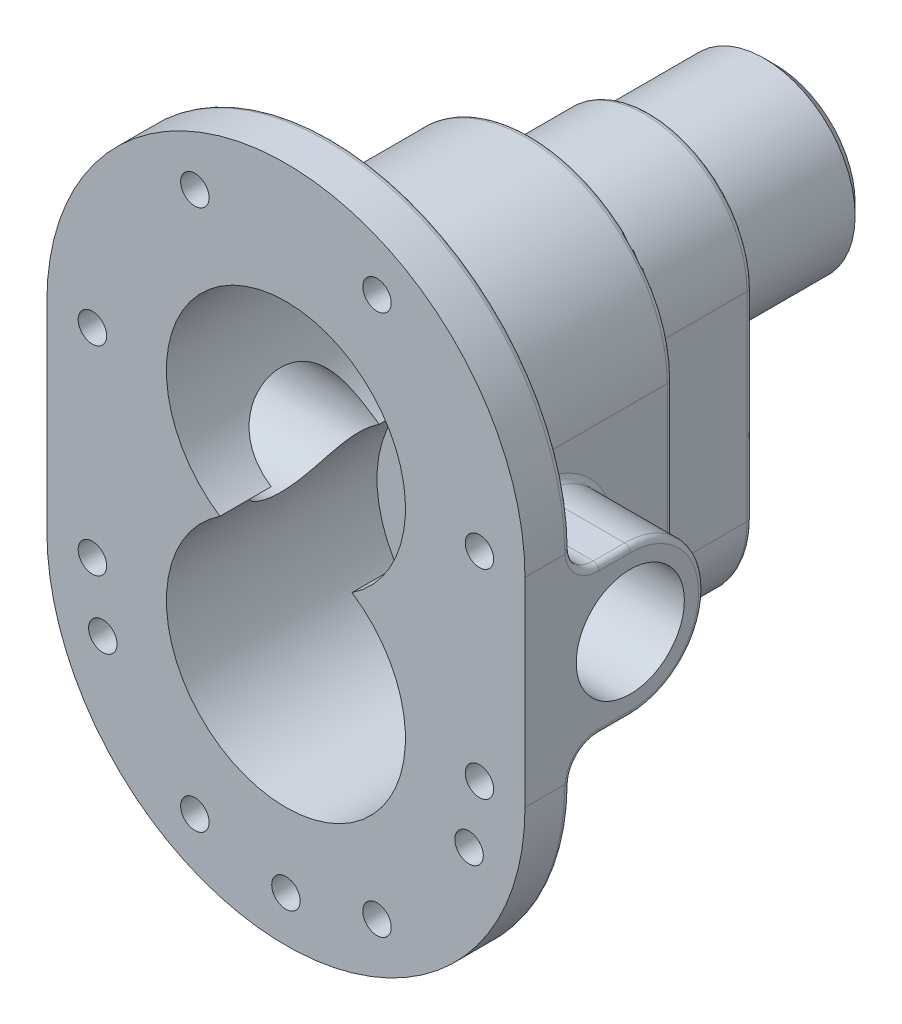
SolidWorks part; units mm, degrees
ref_plane "正面" through (0, 0, 0) normal (0, 0, 1) x (1, 0, 0)
ref_plane "平面" through (0, 0, 0) normal (0, 1, 0) x (1, 0, 0)
ref_plane "右側面" through (0, 0, 0) normal (1, 0, 0) x (0, 0, -1)
sketch "s-歯車軸レイアウト" plane through (0, 0, 0) normal (0, 0, 1) x (1, 0, 0)
  line L0 (0, 0) -> (0, -35) construction
  circle A0 centre (0, 0) radius 10
  circle A1 centre (0, -35) radius 10
  dimension "D1" = 35
  dimension "D2" = 20
sketch "s-歯車ハウジング" plane through (0, 0, 0) normal (0, 0, 1) x (1, 0, 0)
  circle A0 centre (0, 0) radius 21
  circle A1 centre (0, -35) radius 21
  dimension "D1" = 42
sketch "s-カバー1" plane through (0, 0, 0) normal (0, 0, 1) x (1, 0, 0)
  circle A0 centre (0, 0) radius 25
  circle A1 centre (0, -35) radius 25
  dimension "D1" = 50
sketch "s-カバー2" plane through (0, 0, 0) normal (0, 0, 1) x (1, 0, 0)
  circle A0 centre (0, 0) radius 18
  circle A1 centre (0, -35) radius 18
  dimension "D1" = 36
sketch "s-フランジ形状" plane through (0, 0, 0) normal (0, 0, 1) x (1, 0, 0)
  circle A0 centre (0, 0) radius 42
  circle A1 centre (0, -35) radius 42
  dimension "D1" = 84
  dimension "D2" = 119
sketch "s-穴位置1" plane through (0, 0, 0) normal (0, 0, 1) x (1, 0, 0)
  circle A0 centre (0, 0) radius 34
  circle A1 centre (0, -35) radius 34
  dimension "D1" = 68
sketch "s-穴位置2" plane through (0, 0, 0) normal (0, 0, 1) x (1, 0, 0)
  line L0 (-34, 0) -> (-34, -35)
  line L1 (34, 0) -> (34, -35)
  line L2 (16, 30) -> (16, -65) construction
  line L3 (-16, 30) -> (-16, -65) construction
  circle A0 centre (0, 0) radius 34 construction
  circle A1 centre (0, -35) radius 34 construction
  arc A2 (34, 0) -> (-34, 0) centre (0, 0) ccw
  arc A3 (-34, -35) -> (34, -35) centre (0, -35) ccw
  point P5 (16, 30)
  point P10 (-34, 0)
  point P11 (34, 0)
  point P13 (34, -35)
  point P14 (-34, -35)
  point P15 (-16, -65)
  point P16 (16, -65)
  dimension "D1" = 16
  dimension "D2" = 16
sketch "s-穴位置3" plane through (0, 0, 0) normal (0, 0, 1) x (1, 0, 0)
  line L0 (0, -35) -> (0, -69) construction
  line L1 (-32.1714, -46) -> (32.1714, -46) construction
  circle A0 centre (0, -35) radius 34 construction
  dimension "D1" = 11
sketch "s-接続部" plane through (0, 0, 0) normal (0, 0, 1) x (1, 0, 0)
  circle A0 centre (0, 0) radius 16
  dimension "D1" = 32
sketch "s-吸吐口" plane through (0, 0, 0) normal (1, 0, 0) x (0, 0, -1)
  circle A0 centre (18.5, -17.5) radius 13
  dimension "D2" = 26
  dimension "D3" = 17.5
  dimension "D1" = 18.5
sketch "ｽｹｯﾁ10" plane through (0, 0, 0) normal (0, 0, 1) x (1, 0, 0)
  line L0 (-42, 0) -> (-42, -35)
  line L1 (42, 0) -> (42, -35)
  circle A0 centre (0, 0) radius 42 construction
  circle A1 centre (0, -35) radius 42 construction
  arc A2 (42, 0) -> (-42, 0) centre (0, 0) ccw
  arc A3 (-42, -35) -> (42, -35) centre (0, -35) ccw
extrude "ﾎﾞｽ - 押し出し1" add sketch "ｽｹｯﾁ10" against normal blind 8
sketch "ｽｹｯﾁ11" plane through (0, 0, 0) normal (0, 0, 1) x (1, 0, 0)
  line L0 (-25, 0) -> (-25, -35)
  line L1 (25, 0) -> (25, -35)
  circle A2 centre (0, 0) radius 25 construction
  circle A3 centre (0, -35) radius 25 construction
  arc A4 (25, 0) -> (-25, 0) centre (0, 0) ccw
  arc A5 (-25, -35) -> (25, -35) centre (0, -35) ccw
extrude "ﾎﾞｽ - 押し出し2" add sketch "ｽｹｯﾁ11" against normal blind 43
sketch "ｽｹｯﾁ12" plane through (0, 0, 0) normal (0, 0, 1) x (1, 0, 0)
  line L0 (-18, 0) -> (-18, -35)
  line L1 (18, 0) -> (18, -35)
  circle A0 centre (0, 0) radius 18 construction
  circle A1 centre (0, -35) radius 18 construction
  arc A2 (18, 0) -> (-18, 0) centre (0, 0) ccw
  arc A3 (-18, -35) -> (18, -35) centre (0, -35) ccw
extrude "ﾎﾞｽ - 押し出し3" add sketch "ｽｹｯﾁ12" against normal blind 64
sketch "ｽｹｯﾁ13" plane through (0, 0, 0) normal (0, 0, 1) x (1, 0, 0)
  circle A0 centre (0, 0) radius 16 construction
  circle A1 centre (0, 0) radius 16
extrude "ﾎﾞｽ - 押し出し4" add sketch "ｽｹｯﾁ13" against normal blind 86
sketch "ｽｹｯﾁ14" plane through (0, 0, 0) normal (1, 0, 0) x (0, 0, -1)
  line L0 (18.5, -4.5) -> (0, -4.5)
  line L1 (0, -35) -> (0, 0) construction
  line L2 (18.5, -30.5) -> (0, -30.5)
  line L3 (0, -30.5) -> (0, -4.5)
  circle A0 centre (18.5, -17.5) radius 13 construction
  arc A1 (18.5, -30.5) -> (18.5, -4.5) centre (18.5, -17.5) ccw
extrude "ﾎﾞｽ - 押し出し5" add sketch "ｽｹｯﾁ14" along normal up to surface and the other way up to surface
sketch "ｽｹｯﾁ15" plane through (0, 0, 0) normal (0, 0, 1) x (1, 0, 0)
  circle A0 centre (0, 0) radius 21 construction
  circle A1 centre (0, -35) radius 21 construction
  arc A2 (11.6082, -17.5) -> (-11.6082, -17.5) centre (0, 0) ccw
  arc A3 (-11.6082, -17.5) -> (11.6082, -17.5) centre (0, -35) ccw
extrude "ｶｯﾄ - 押し出し1" cut sketch "ｽｹｯﾁ15" against normal blind 37
sketch "ｽｹｯﾁ16" plane through (0, 0, -37) normal (0, 0, 1) x (1, 0, 0)
  circle A0 centre (0, 0) radius 10 construction
  circle A1 centre (0, 0) radius 10
extrude "ｶｯﾄ - 押し出し2" cut sketch "ｽｹｯﾁ16" against normal through all
sketch "ｽｹｯﾁ17" plane through (0, 0, -37) normal (0, 0, 1) x (1, 0, 0)
  circle A0 centre (0, -35) radius 10 construction
  circle A1 centre (0, -35) radius 10
extrude "ｶｯﾄ - 押し出し3" cut sketch "ｽｹｯﾁ17" against normal blind 19
sketch "ｽｹｯﾁ18" plane through (0, 0, -86) normal (0, 0, -1) x (-1, 0, 0)
  circle A0 centre (0, 0) radius 13
  dimension "D1" = 26
extrude "ｶｯﾄ - 押し出し4" cut sketch "ｽｹｯﾁ18" against normal blind 10.5
hole_wizard "G1/2 ねじ穴1" positions "ｽｹｯﾁ20" profile "ｽｹｯﾁ19" tap size "G1/2" standard "Jis"
sketch "ｽｹｯﾁ20" plane through (42, 0, 0) normal (1, 0, 0) x (0, 0, -1)
  point P0 (18.5, -17.5)
sketch "ｽｹｯﾁ19" plane through (42, -17.5, -18.5) normal (0, 1, 0) x (0, 0, -1)
  line L0 (0, 0) -> (0, 30.3918)
  line L1 (0, 30.3918) -> (9.5, 30.3918)
  line L2 (9.5, 30.3918) -> (9.5, 0)
  line L5 (9.5, 0) -> (0, 0)
  line L11 (0, -6.35) -> (0, 107.95) construction
  dimension "次ｻｰﾌｪｽまでのねじ下穴ﾄﾞﾘﾙ直径" = 19
  dimension "次ｻｰﾌｪｽまでのねじ下穴ﾄﾞﾘﾙの深さ" = 30.3918
hole_wizard "G1/2 ねじ穴2" positions "ｽｹｯﾁ22" profile "ｽｹｯﾁ21" tap size "G1/2" standard "Jis"
sketch "ｽｹｯﾁ22" plane through (-42, 0, 0) normal (-1, 0, 0) x (0, 0, 1)
  point P0 (-18.5, -17.5)
sketch "ｽｹｯﾁ21" plane through (-42, -17.5, -18.5) normal (0, 1, 0) x (0, 0, 1)
  line L0 (0, 0) -> (0, 30.3918)
  line L1 (0, 30.3918) -> (9.5, 30.3918)
  line L2 (9.5, 30.3918) -> (9.5, 0)
  line L5 (9.5, 0) -> (0, 0)
  line L11 (0, -6.35) -> (0, 107.95) construction
  dimension "次ｻｰﾌｪｽまでのねじ下穴ﾄﾞﾘﾙ直径" = 19
  dimension "次ｻｰﾌｪｽまでのねじ下穴ﾄﾞﾘﾙの深さ" = 30.3918
hole_wizard "M6x1.0 ねじ穴1" positions "ｽｹｯﾁ25" profile "ｽｹｯﾁ24" tap size "M6x1.0" standard "Jis"
sketch "ｽｹｯﾁ25" plane through (0, 0, 0) normal (0, 0, 1) x (1, 0, 0)
  point P10 (-16, 30)
sketch "ｽｹｯﾁ24" plane through (-16, 30, 0) normal (1, 0, 0) x (0, -1, 0)
  line L0 (0, 0) -> (0, 8.001)
  line L1 (0, 8.001) -> (2.5, 8.001)
  line L2 (2.5, 8.001) -> (2.5, 0)
  line L5 (2.5, 0) -> (0, 0)
  line L11 (0, -6.35) -> (0, 107.95) construction
  dimension "次ｻｰﾌｪｽまでのねじ下穴ﾄﾞﾘﾙ直径" = 5
  dimension "次ｻｰﾌｪｽまでのねじ下穴ﾄﾞﾘﾙの深さ" = 8.001
pattern_sketch "ｽｹｯﾁ-ﾊﾟﾀｰﾝ1" of "M6x1.0 ねじ穴1"
hole_wizard "M6x1.0 ねじ穴2" positions "ｽｹｯﾁ27" profile "ｽｹｯﾁ26" tap size "M6x1.0" standard "Jis"
sketch "ｽｹｯﾁ27" plane through (-32.9422, 6.6983, -8) normal (0, 0, 1) x (1, 0, 0)
  point P0 (0.7708, -52.6983)
  point P3 (32.9422, -75.6983)
  point P6 (65.1136, -52.6983)
sketch "ｽｹｯﾁ26" plane through (-32.1714, -46, -8) normal (1, 0, 0) x (0, 1, 0)
  line L0 (0, 0) -> (0, 8)
  line L1 (0, 8) -> (2.5, 8)
  line L2 (2.5, 8) -> (2.5, 0)
  line L5 (2.5, 0) -> (0, 0)
  line L11 (0, -6.35) -> (0, 107.95) construction
  dimension "次ｻｰﾌｪｽまでのねじ下穴ﾄﾞﾘﾙ直径" = 5
  dimension "次ｻｰﾌｪｽまでのねじ下穴ﾄﾞﾘﾙの深さ" = 8
fillet "ﾌｨﾚｯﾄ1" radius 5 4 edges at (-33.5, -4.5, -8) (-33.5, -30.5, -8) (33.5, -30.5, -8) (33.5, -4.5, -8)
fillet "ﾌｨﾚｯﾄ2" radius 1 41 edges at (-18, -17.5, -64) (0, 18, -64) (18, -17.5, -64) (-25, -17.5, -43) (0, 25, -43) (25, -17.5, -43) (25, -3.2081, -9.6459) (25, -4.5, -15.75) (25, -17.5, -31.5) (25, -30.5, -15.75) (25, -31.7919, -9.6459) (0, -60, -8) (-25, -31.7919, -9.6459) (-25, -30.5, -15.75) (-25, -17.5, -31.5) (-25, -4.5, -15.75) (-25, -3.2081, -9.6459) (42, -3.2081, -9.6459) (42, -4.5, -15.75) (42, -17.5, -31.5) (-42, -17.5, -31.5) (42, -30.5, -15.75) (42, -31.7919, -9.6459) (0, -77, -8) (-42, -31.7919, -9.6459) (-42, -30.5, -15.75) (-42, -4.5, -15.75) (-42, -3.2081, -9.6459) (16, 0, -64) (0, -53, -64) (0, -60, -43) (0, 25, -8) (0, 42, -8)
chamfer "面取り1" distance 2 angle 45 1 edges at (16, 0, -86)
